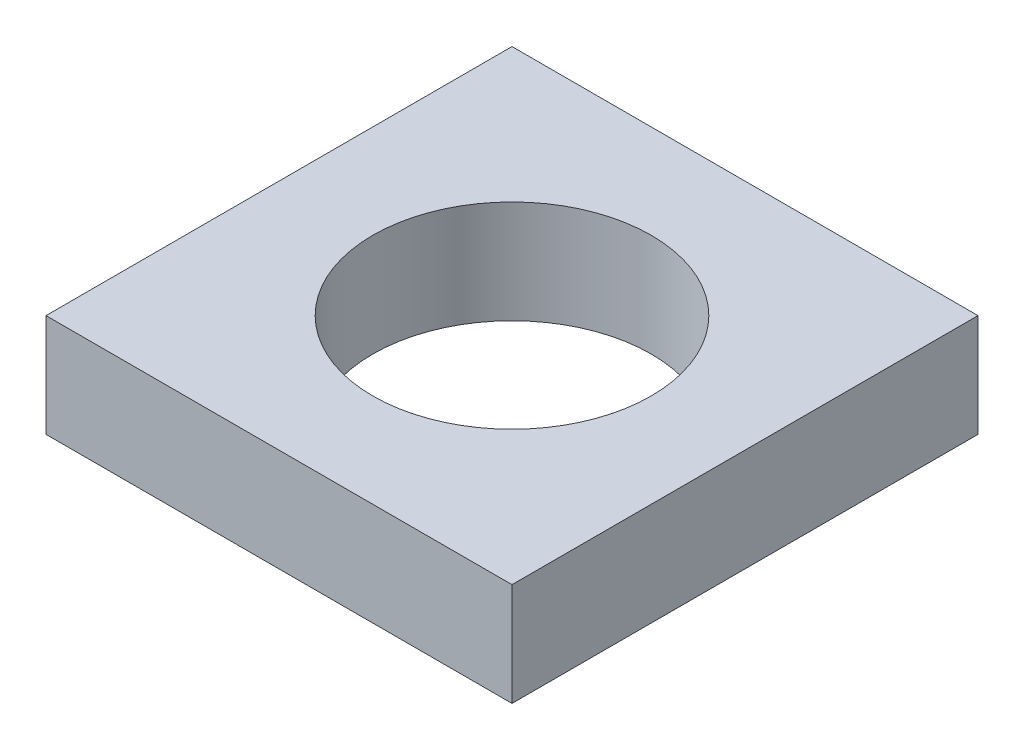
SolidWorks part; units mm, degrees
ref_plane "Front Plane" through (0, 0, 0) normal (0, 0, 1) x (1, 0, 0)
ref_plane "Top Plane" through (0, 0, 0) normal (0, 1, 0) x (1, 0, 0)
ref_plane "Right Plane" through (0, 0, 0) normal (1, 0, 0) x (0, 0, -1)
sketch "Sketch1" plane through (0, 0, 0) normal (0, 1, 0) x (1, 0, 0)
  line L1 (-4.8895, 4.8895) -> (4.8895, 4.8895)
  line L2 (-4.8895, 4.8895) -> (-4.8895, -4.8895)
  line L3 (-4.8895, -4.8895) -> (4.8895, -4.8895)
  line L4 (4.8895, 4.8895) -> (4.8895, -4.8895)
  line L5 (-4.8895, 4.8895) -> (4.8895, -4.8895) construction
  line L6 (-4.8895, -4.8895) -> (4.8895, 4.8895) construction
  point P0 (0, 0)
  dimension "D1" = 9.779
extrude "Boss-Extrude1" add sketch "Sketch1" along normal blind 2.159
sketch "Sketch2" plane through (0, 2.159, 0) normal (0, 1, 0) x (1, 0, 0)
  circle A0 centre (0, 0) radius 2.921
  dimension "D1" = 5.842
extrude "Cut-Extrude1" cut sketch "Sketch2" against normal through all
